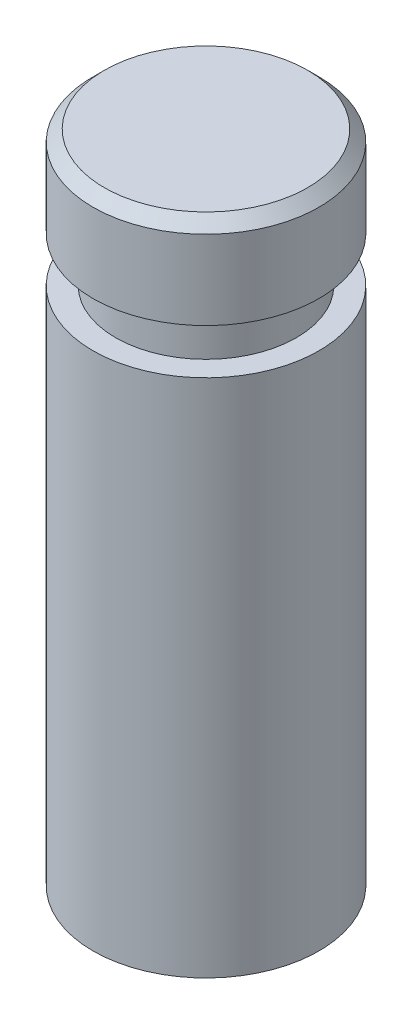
SolidWorks part; units mm, degrees
ref_plane "Face" through (0, 0, 0) normal (0, 0, 1) x (1, 0, 0)
ref_plane "Dessus" through (0, 0, 0) normal (0, 1, 0) x (1, 0, 0)
ref_plane "Droite" through (0, 0, 0) normal (1, 0, 0) x (0, 0, -1)
sketch "Esquisse1" plane through (0, 0, 0) normal (0, 0, 1) x (1, 0, 0)
  line L0 (0, 0) -> (0, 58)
  line L1 (0, 58) -> (10, 58)
  line L2 (10, 58) -> (10, 50)
  line L3 (0, 63.2832) -> (0, -10.3788) construction
  line L4 (10, 50) -> (8, 50)
  line L5 (8, 50) -> (8, 46)
  line L6 (8, 46) -> (10, 46)
  line L7 (10, 46) -> (10, 0)
  line L8 (10, 0) -> (0, 0)
  dimension "D1" = 58
  dimension "D2" = 10
  dimension "D3" = 10
  dimension "D4" = 8
  dimension "D5" = 8
  dimension "D6" = 4
revolve "Révolution1" add sketch "Esquisse1" angle 360 about L3
chamfer "Chanfrein1" distance 1 angle 45 1 edges at (0, 58, 10)
